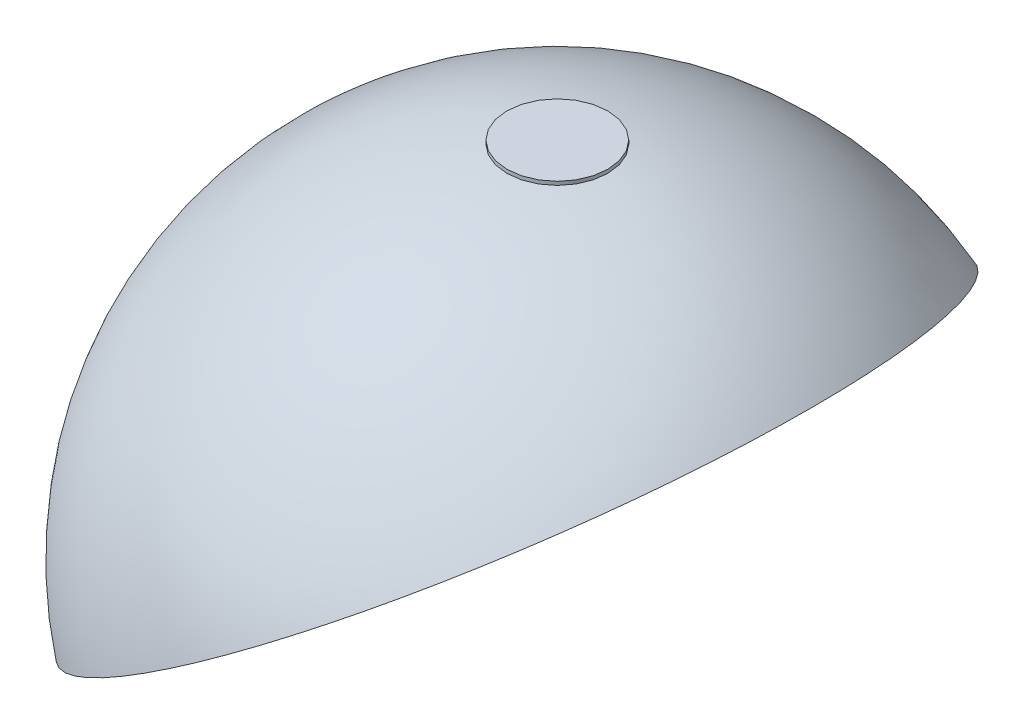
SolidWorks part; units mm, degrees
ref_plane "Płaszczyzna przednia" through (0, 0, 0) normal (0, 0, 1) x (1, 0, 0)
ref_plane "Płaszczyzna górna" through (0, 0, 0) normal (0, 1, 0) x (1, 0, 0)
ref_plane "Płaszczyzna prawa" through (0, 0, 0) normal (1, 0, 0) x (0, 0, -1)
sketch "Szkic1" plane through (0, 0, 0) normal (0, 0, 1) x (1, 0, 0)
  line L0 (35.1495, 35.56) -> (-46.2741, -18.9395)
  line L1 (-27.8116, 41.5513) -> (0, 0) construction
  line L2 (0, 0) -> (43.6504, -65.2148) construction
  line L3 (0, 50) -> (0, -60.8615) construction
  circle A0 centre (0, 0) radius 50
  point P8 (-27.8116, 41.5513)
  dimension "D1" = 100
  dimension "D2" = 40
  dimension "D3" = 38
sketch "Szkic3" plane through (0, 0, 0) normal (0, 0, 1) x (1, 0, 0)
  line L0 (-27.8116, 41.5513) -> (0, 0) construction
  line L3 (-27.8116, 41.5513) -> (0, 0) construction
  line L4 (35.1495, 35.56) -> (29.1921, 31.5725)
  line L5 (35.1495, 35.56) -> (-46.2741, -18.9395) construction
  line L6 (29.1921, 31.5725) -> (22.6945, 41.28)
  line L7 (22.6945, 41.28) -> (-10.0413, 41.8111)
  line L8 (-10.0413, 41.8111) -> (-23.918, 35.7341)
  line L9 (-27.8116, 41.5513) -> (-23.918, 35.7341)
  circle A0 centre (0, 0) radius 50 construction
  arc A1 (35.1495, 35.56) -> (-27.8116, 41.5513) centre (0, 0) ccw
revolve "Obrót1" add sketch "Szkic3" angle 360 about L3
sketch "Szkic4" plane through (0, 0, 0) normal (0, 0, 1) x (1, 0, 0)
  line L0 (0, 49.305) -> (6.9806, 49.305)
  line L1 (0, 50) -> (0, -60.8615) construction
  line L2 (6.9806, 49.305) -> (6.9806, 50.005)
  line L3 (6.9806, 50.005) -> (0, 50.005)
  line L4 (0, 50.005) -> (0, 49.305)
revolve "Obrót2" add sketch "Szkic4" angle 360 about L4
thread "Gwint1" pitch 1.25 start angle 0, offset 0, length 10, pitch 1.25, diameter 83.6421
ref_plane "Płaszczyzna1" through (29.1921, 31.5725, 0) normal (0, 0, 1) x (0.831, 0.5562, 0)
sketch "Profil gwintu1" plane through (29.1921, 31.5725, 0) normal (0, 0, 1) x (0.831, 0.5562, 0)
  line L0 (0, 0) -> (0, 1.25) construction
  line L1 (0, 0) -> (0.6766, 0.3906)
  line L2 (0.6766, 0.3906) -> (0.6766, 0.5469)
  line L3 (0.6766, 0.5469) -> (0, 0.9375)
  line L4 (0.6766, 0.4687) -> (0, 0.4687) construction
  line L11 (0, 0) -> (0, 0.9375)
  point P2 (0, 0)
  dimension "Pitch" = 1.25
  dimension "Profile_Angle" = 60
  dimension "Profile_Land" = 0.1562
  dimension "Profile_Height" = 0.6766
